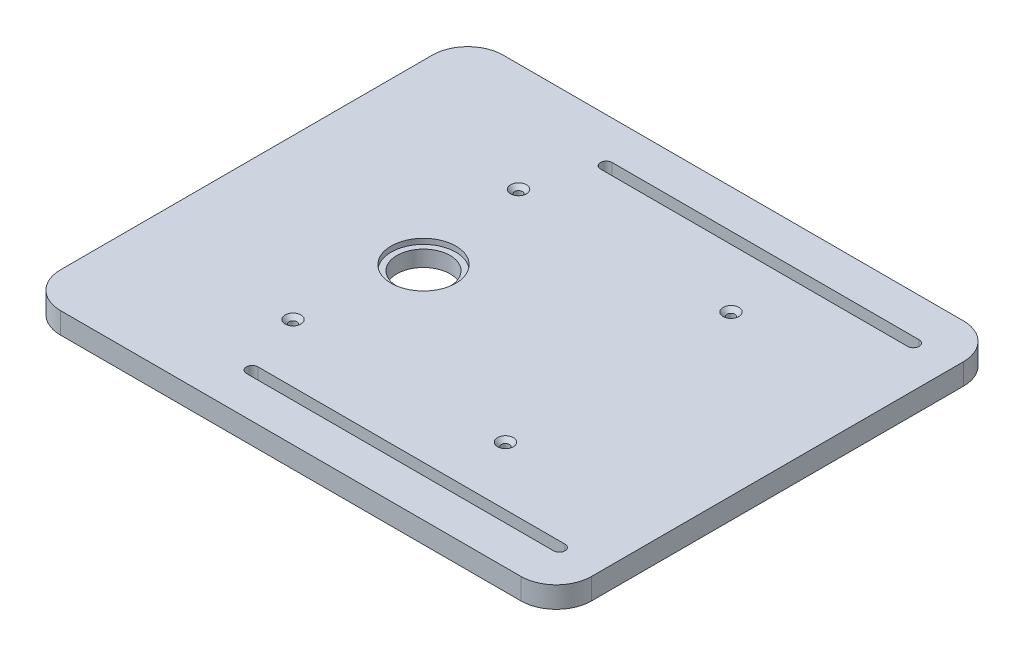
SolidWorks part; units mm, degrees
ref_plane "Front Plane" through (0, 0, 0) normal (0, 0, 1) x (1, 0, 0)
ref_plane "Top Plane" through (0, 0, 0) normal (0, 1, 0) x (1, 0, 0)
ref_plane "Right Plane" through (0, 0, 0) normal (1, 0, 0) x (0, 0, -1)
sketch "Sketch1" plane through (0, 0, 0) normal (0, 1, 0) x (1, 0, 0)
  line L1 (20, 0) -> (280, 0)
  line L2 (0, 20) -> (0, 230)
  line L3 (20, 250) -> (280, 250)
  line L4 (300, 20) -> (300, 230)
  arc A0 (20, 0) -> (0, 20) centre (20, 20) cw
  arc A1 (280, 0) -> (300, 20) centre (280, 20) ccw
  arc A2 (280, 250) -> (300, 230) centre (280, 230) cw
  arc A3 (0, 230) -> (20, 250) centre (20, 230) cw
  point P7 (0, 0)
  point P10 (300, 0)
  point P13 (300, 250)
  point P16 (0, 250)
  dimension "D3" = 20
  dimension "D1" = 300
  dimension "D2" = 250
extrude "Boss-Extrude1" add sketch "Sketch1" along normal blind 12
hole_wizard "CBORE for M5 Hex Head Bolt1" positions "Sketch3" profile "Sketch2" counterbore size "M5" standard "DIN"
sketch "Sketch3" plane through (0, 12, 0) normal (0, 1, 0) x (1, 0, 0)
  line L0 (0, -6.6) -> (0, 6.6) construction
  line L2 (280, 250) -> (20, 250) construction
  point P0 (100, 125)
  dimension "D1" = 100
  dimension "D2" = 125
sketch "Sketch2" plane through (100, 12, -125) normal (1, 0, 0) x (0, 0, 1)
  line L0 (0, 0) -> (0, 12)
  line L1 (0, 12) -> (15, 12)
  line L3 (15, 12) -> (15, 3)
  line L4 (15, 3) -> (18.25, 3)
  line L5 (18.25, 3) -> (18.25, 0)
  line L7 (18.25, 0) -> (0, 0)
  line L11 (0, -6.35) -> (0, 107.95) construction
  dimension "Thru Hole Dia." = 30
  dimension "Thru Hole Depth" = 12
  dimension "C'Bore Dia." = 36.5
  dimension "C'Bore Depth" = 3
hole_wizard "Ø6.0mm Clearance Dowel Slot1" positions "Sketch7" profile "Sketch6" size "Ø6.0" standard "ANSI Metric"
sketch "Sketch7" plane through (0, 12, 0) normal (0, 1, 0) x (1, 0, 0)
  line L0 (100, 25) -> (280, 25) construction
  line L1 (-6.6, 0) -> (6.6, 0) construction
  line L2 (280, 250) -> (20, 250) construction
  line L3 (300, 20) -> (300, 230) construction
  point P0 (190, 25)
  point P4 (190, 225)
  dimension "D1" = 180
  dimension "D2" = 25
  dimension "D3" = 25
  dimension "D4" = 110
  dimension "D5" = 110
sketch "Sketch6" plane through (190, 12, -25) normal (1, 0, 0) x (0, 0, 1)
  line L0 (0, 0) -> (0, 12)
  line L1 (0, 12) -> (3.25, 12)
  line L2 (3.25, 12) -> (3.25, 0)
  line L5 (3.25, 0) -> (0, 0)
  line L11 (0, -6.35) -> (0, 107.95) construction
  dimension "Thru Hole Dia." = 6.5
  dimension "Thru Hole Depth" = 12
sketch "Sketch9" plane through (0, 0, 0) normal (0, -1, 0) x (1, 0, 0)
  line L0 (300, -125) -> (0, -125) construction
  line L1 (81, -55.2) -> (219, -55.2)
  line L2 (75, -55.2) -> (75, -67.4)
  line L3 (81, -67.4) -> (219, -67.4)
  line L4 (225, -55.2) -> (225, -67.4)
  line L5 (300, -20) -> (300, -230) construction
  line L6 (0, -6.6) -> (0, 6.6) construction
  arc A0 (81, -55.2) -> (75, -55.2) centre (78, -55.2) ccw
  arc A1 (75, -67.4) -> (81, -67.4) centre (78, -67.4) ccw
  arc A2 (225, -55.2) -> (219, -55.2) centre (222, -55.2) ccw
  arc A3 (219, -67.4) -> (225, -67.4) centre (222, -67.4) ccw
  dimension "D5" = 6
  dimension "D1" = 12.2
  dimension "D2" = 57.6
  dimension "D3" = 150
  dimension "D4" = 75
extrude "Cut-Extrude3" cut sketch "Sketch9" against normal blind 2
ref_plane "Plane1" through (0, 0, -125) normal (0, 0, 1) x (1, 0, 0)
mirror "Mirror1" about plane through (0, 0, -125) normal (0, 0, 1) of "Cut-Extrude3"
hole_wizard "CSK for M4 SFHCS1" positions "Sketch11" profile "Sketch10" countersink size "M4" standard "ANSI Metric"
sketch "Sketch11" plane through (0, 12, 0) normal (0, 1, 0) x (1, 0, 0)
  line L0 (280, 250) -> (20, 250) construction
  line L1 (-6.6, 0) -> (6.6, 0) construction
  line L2 (300, 20) -> (300, 230) construction
  line L3 (0, -6.6) -> (0, 6.6) construction
  point P0 (90, 188.7)
  point P2 (210, 188.7)
  point P4 (210, 61.3)
  point P6 (90, 61.3)
  dimension "D1" = 61.3
  dimension "D2" = 61.3
  dimension "D3" = 90
  dimension "D4" = 90
  dimension "D5" = 90
  dimension "D6" = 90
sketch "Sketch10" plane through (90, 12, -188.7) normal (1, 0, 0) x (0, 0, 1)
  line L0 (0, 0) -> (0, 12)
  line L1 (0, 12) -> (2.25, 12)
  line L2 (2.25, 12) -> (2.25, 2.23)
  line L3 (2.25, 2.23) -> (4.48, 0)
  line L5 (4.48, 0) -> (0, 0)
  line L6 (-2.25, 2.23) -> (-4.48, 0) construction
  line L11 (0, -6.35) -> (0, 107.95) construction
  dimension "Thru Hole Dia." = 4.5
  dimension "Thru Hole Depth" = 12
  dimension "Near C'Sink Dia." = 8.96
  dimension "Near C'Sink Angle" = 90
